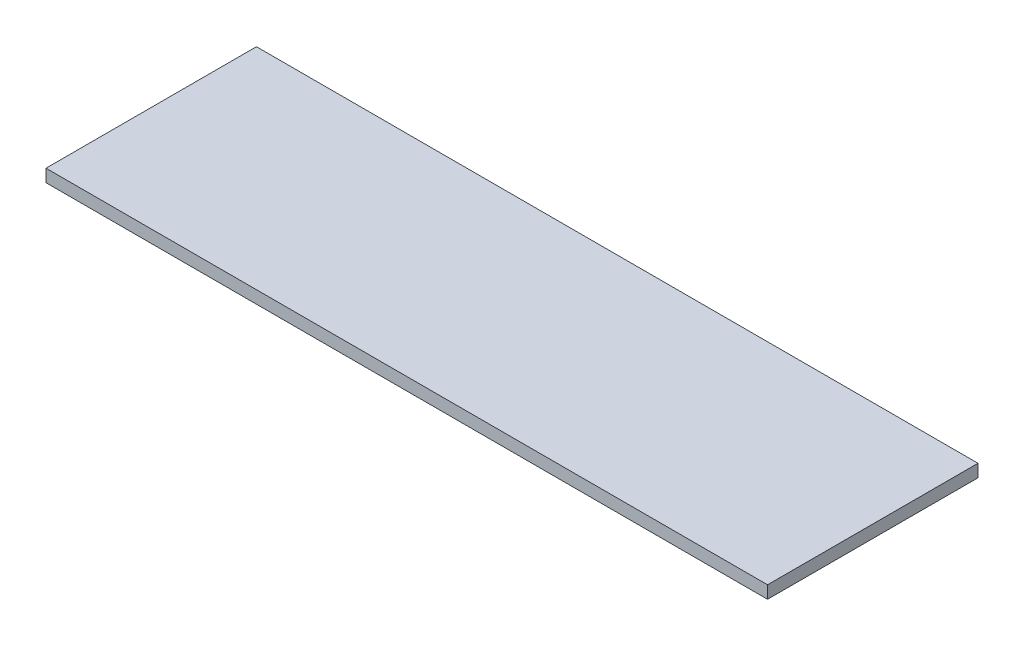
SolidWorks part; units mm, degrees
ref_plane "Front Plane" through (0, 0, 0) normal (0, 0, 1) x (1, 0, 0)
ref_plane "Top Plane" through (0, 0, 0) normal (0, 1, 0) x (1, 0, 0)
ref_plane "Right Plane" through (0, 0, 0) normal (1, 0, 0) x (0, 0, -1)
sketch "Sketch1" plane through (0, 0, 0) normal (0, 1, 0) x (1, 0, 0)
  line L1 (-76.2, 22.225) -> (76.2, 22.225)
  line L2 (-76.2, 22.225) -> (-76.2, -22.225)
  line L3 (-76.2, -22.225) -> (76.2, -22.225)
  line L4 (76.2, 22.225) -> (76.2, -22.225)
  point P4 (0, 22.225)
  point P5 (-76.2, 0)
  dimension "D1" = 44.45
  dimension "D2" = 152.4
extrude "12ga plate" add sketch "Sketch1" along normal blind 2.6568
